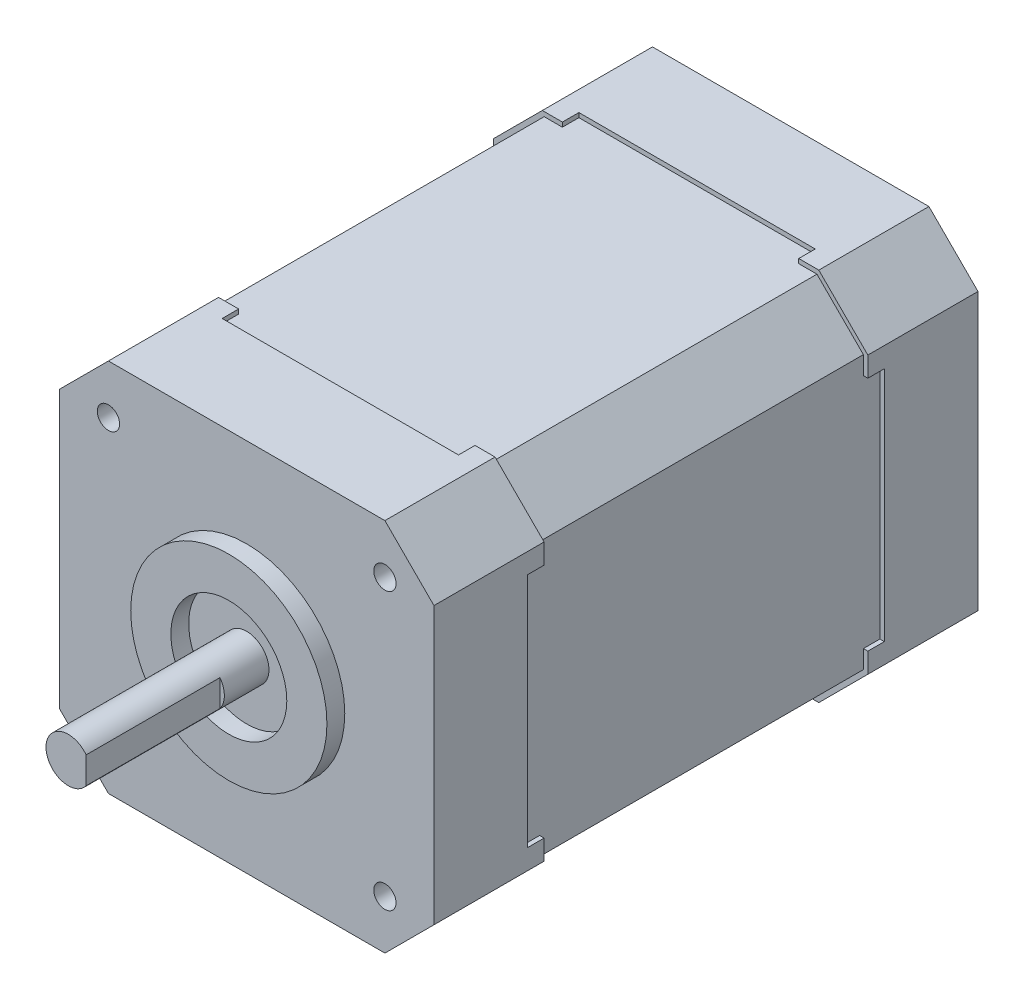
SolidWorks part; units mm, degrees
ref_plane "前基準面" through (0, 0, 0) normal (0, 0, 1) x (1, 0, 0)
ref_plane "上基準面" through (0, 0, 0) normal (0, 1, 0) x (1, 0, 0)
ref_plane "右基準面" through (0, 0, 0) normal (1, 0, 0) x (0, 0, -1)
sketch "草圖1" plane through (0, 0, 0) normal (0, 0, 1) x (1, 0, 0)
  line L0 (-21, 15.5) -> (-15.5, 21)
  line L1 (-15.5, 21) -> (15.5, 21)
  line L2 (-21, 15.5) -> (-21, -15.5)
  line L3 (-15.5, -21) -> (15.5, -21)
  line L4 (21, 15.5) -> (21, -15.5)
  line L5 (-18.25, 18.25) -> (18.25, -18.25) construction
  line L6 (-18.25, -18.25) -> (18.25, 18.25) construction
  line L7 (-21, -15.5) -> (-15.5, -21)
  line L8 (15.5, -21) -> (21, -15.5)
  line L9 (15.5, 21) -> (21, 15.5)
  point P0 (0, 0)
  dimension "D1" = 42
  dimension "D2" = 21
  dimension "D3" = 42
  dimension "D4" = 21
  dimension "D5" = 5.5
  dimension "D6" = 5.5
  dimension "D7" = 31
  dimension "D8" = 5.5
  dimension "D9" = 31
  dimension "D10" = 5.5
  dimension "D11" = 31
  dimension "D12" = 31
extrude "填料-伸長1" add sketch "草圖1" against normal blind 61
sketch "草圖2" plane through (0, 0, 0) normal (0, 0, 1) x (1, 0, 0)
  circle A0 centre (0, 0) radius 11
  circle A1 centre (0, 0) radius 6.5
  dimension "D1" = 22
  dimension "D2" = 13
extrude "填料-伸長2" add sketch "草圖2" along normal blind 2
sketch "草圖3" plane through (0, 0, 0) normal (0, 0, 1) x (1, 0, 0)
  circle A0 centre (0, 0) radius 2.5
  dimension "D1" = 5
extrude "填料-伸長3" add sketch "草圖3" along normal blind 20
sketch "草圖4" plane through (0, 0, 20) normal (0, 0, 1) x (1, 0, 0)
  line L0 (2, 1.5) -> (2, -1.5)
  arc A0 (2, -1.5) -> (2, 1.5) centre (0, 0) ccw
  dimension "D1" = 5
  dimension "D3" = 2
extrude "除料-伸長1" cut sketch "草圖4" against normal blind 15
ref_plane "平面1" through (0, 0, -12.35) normal (0, 0, 1) x (1, 0, 0)
sketch "草圖5" plane through (0, 0, -12.35) normal (0, 0, 1) x (1, 0, 0)
  line L0 (15.5, 21) -> (-15.5, 21) construction
  line L1 (21, 15.5) -> (15.5, 21) construction
  line L2 (21, -15.5) -> (21, 15.5) construction
  line L3 (15.5, -21) -> (21, -15.5) construction
  line L4 (-15.5, -21) -> (15.5, -21) construction
  line L5 (-21, -15.5) -> (-15.5, -21) construction
  line L6 (-21, 15.5) -> (-21, -15.5) construction
  line L7 (-15.5, 21) -> (-21, 15.5) construction
  line L8 (15.5, 21) -> (-15.5, 21)
  line L9 (21, 15.5) -> (15.5, 21)
  line L10 (21, -15.5) -> (21, 15.5)
  line L11 (15.5, -21) -> (21, -15.5)
  line L12 (-15.5, -21) -> (15.5, -21)
  line L13 (-21, -15.5) -> (-15.5, -21)
  line L14 (-21, 15.5) -> (-21, -15.5)
  line L15 (-15.5, 21) -> (-21, 15.5)
sketch "草圖6" plane through (0, 0, 0) normal (1, 0, 0) x (0, 0, -1)
  line L0 (12.35, 21) -> (12.35, 15.5) construction
  line L1 (12.35, 21) -> (48.65, 21)
  line L2 (12.35, 21) -> (12.35, 20.5)
  line L3 (12.35, 20.5) -> (48.65, 20.5)
  line L4 (48.65, 21) -> (48.65, 20.5)
  line L5 (61, 21) -> (0, 21) construction
  line L7 (61, 15.5) -> (61, 21) construction
  dimension "D1" = 0.5
  dimension "D2" = 12.35
sweep "除料-掃出1" cut profiles "草圖6" path "草圖5"
sketch "草圖7" plane through (0, 21, 0) normal (0, 1, 0) x (1, 0, 0)
  line L0 (15.5, 0) -> (-15.5, 0) construction
  line L1 (-13.25, 50.5) -> (13.25, 50.5)
  line L2 (-13.25, 50.5) -> (-13.25, 10.5)
  line L3 (-13.25, 10.5) -> (13.25, 10.5)
  line L4 (13.25, 50.5) -> (13.25, 10.5)
  line L6 (15.5, 61) -> (-15.5, 61) construction
  dimension "D1" = 10.5
  dimension "D2" = 26.5
  dimension "D3" = 13.25
  dimension "D4" = 10.5
extrude "除料-伸長2" cut sketch "草圖7" against normal up to surface (0.5 mm away)
sketch "草圖8" plane through (21, 0, 0) normal (1, 0, 0) x (0, 0, -1)
  line L0 (0, 11) -> (0, -11) construction
  line L1 (10.5, 13.25) -> (50.5, 13.25)
  line L2 (10.5, 13.25) -> (10.5, -13.25)
  line L3 (10.5, -13.25) -> (50.5, -13.25)
  line L4 (50.5, 13.25) -> (50.5, -13.25)
  line L5 (61, -15.5) -> (61, 15.5) construction
  dimension "D1" = 26.5
  dimension "D2" = 10.5
  dimension "D3" = 10.5
  dimension "D4" = 13.25
extrude "除料-伸長3" cut sketch "草圖8" against normal up to surface (0.5 mm away)
sketch "草圖9" plane through (0, -21, 0) normal (0, -1, 0) x (1, 0, 0)
  line L0 (-15.5, 0) -> (15.5, 0) construction
  line L1 (-13.25, -10.5) -> (13.25, -10.5)
  line L2 (-13.25, -10.5) -> (-13.25, -50.5)
  line L3 (-13.25, -50.5) -> (13.25, -50.5)
  line L4 (13.25, -10.5) -> (13.25, -50.5)
  line L5 (-15.5, -61) -> (15.5, -61) construction
  dimension "D1" = 13.25
  dimension "D2" = 26.5
  dimension "D3" = 10.5
  dimension "D4" = 10.5
extrude "除料-伸長4" cut sketch "草圖9" against normal up to surface (0.5 mm away)
sketch "草圖10" plane through (-21, 0, 0) normal (-1, 0, 0) x (0, 0, 1)
  line L0 (0, 15.5) -> (0, -15.5) construction
  line L1 (-50.5, 13.25) -> (-10.5, 13.25)
  line L2 (-50.5, 13.25) -> (-50.5, -13.25)
  line L3 (-50.5, -13.25) -> (-10.5, -13.25)
  line L4 (-10.5, 13.25) -> (-10.5, -13.25)
  line L5 (-61, 15.5) -> (-61, -15.5) construction
  dimension "D1" = 26.5
  dimension "D2" = 13.25
  dimension "D3" = 10.5
  dimension "D4" = 10.5
extrude "除料-伸長5" cut sketch "草圖10" against normal up to surface (0.5 mm away)
hole_wizard "M3 螺紋孔1" positions "草圖12" profile "草圖11" tap size "M3" standard "ISO"
sketch "草圖12" plane through (0, 0, 0) normal (0, 0, 1) x (1, 0, 0)
  point P1 (-15.5, 15.5)
  point P3 (15.5, 15.5)
  point P5 (15.5, -15.5)
  point P7 (-15.5, -15.5)
  dimension "D1" = 15.5
  dimension "D2" = 15.5
  dimension "D3" = 31
  dimension "D4" = 15.5
  dimension "D5" = 31
  dimension "D6" = 15.5
  dimension "D7" = 31
  dimension "D8" = 31
sketch "草圖11" plane through (-15.5, 15.5, 0) normal (1, 0, 0) x (0, -1, 0)
  line L0 (0, 0) -> (0, 5.2511)
  line L1 (0, 5.2511) -> (1.25, 4.5)
  line L2 (1.25, 4.5) -> (1.25, 0)
  line L5 (1.25, 0) -> (0, 0)
  line L10 (0, 5.2511) -> (-1.25, 4.5) construction
  line L11 (0, -6.35) -> (0, 107.95) construction
  dimension "螺孔鑽直徑" = 2.5
  dimension "螺孔鑽深度" = 4.5
  dimension "導頭角度" = 118
